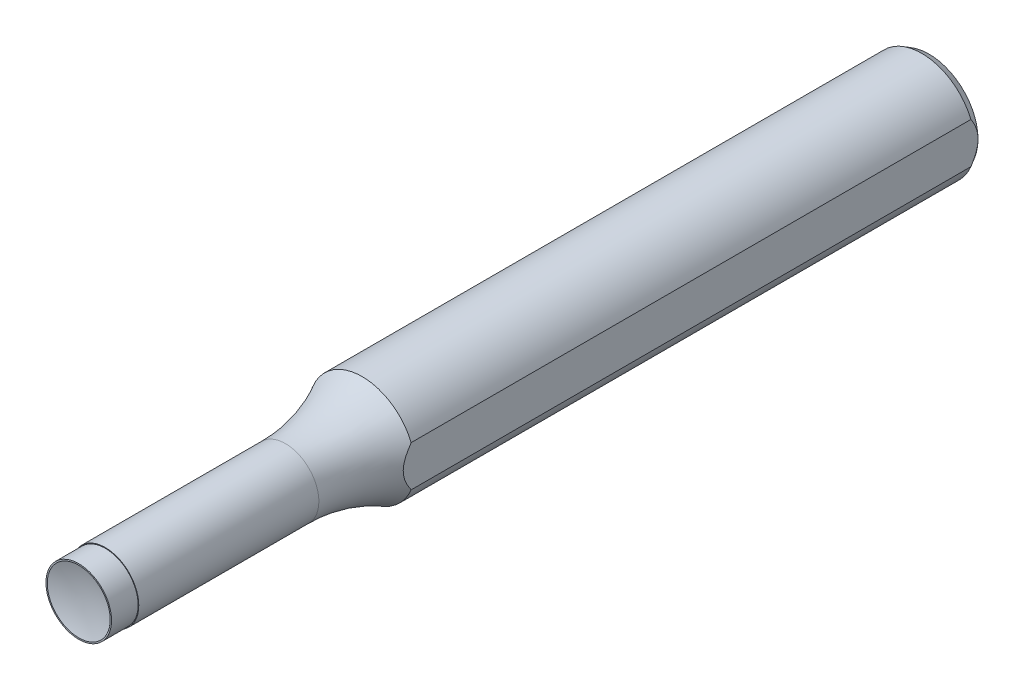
SolidWorks part; units mm, degrees
ref_plane "Front Plane" through (0, 0, 0) normal (0, 0, 1) x (1, 0, 0)
ref_plane "Top Plane" through (0, 0, 0) normal (0, 1, 0) x (1, 0, 0)
ref_plane "Right Plane" through (0, 0, 0) normal (1, 0, 0) x (0, 0, -1)
sketch "Sketch1" plane through (0, 0, 0) normal (0, 0, 1) x (1, 0, 0)
  circle A0 centre (0, 0) radius 7.94
  dimension "D1" = 15.88
extrude "Boss-Extrude1" add sketch "Sketch1" against normal blind 127
sketch "Sketch2" plane through (0, 0, 0) normal (0, 0, 1) x (1, 0, 0)
  circle A0 centre (0, 0) radius 5
  dimension "D1" = 10
extrude "Cut-Extrude1" cut sketch "Sketch2" against normal blind 42.3333 flip side to cut
sketch "Sketch3" plane through (0, 0, 0) normal (0, 0, 1) x (1, 0, 0)
  circle A0 centre (0, 0) radius 4.9
  dimension "D1" = 9.8
extrude "Cut-Extrude2" cut sketch "Sketch3" against normal blind 3.97 flip side to cut
sketch "Sketch4" plane through (0, 0, 0) normal (1, 0, 0) x (0, 0, -1)
  line L0 (0, 0) -> (0, 4.7)
  line L1 (0, 4.9) -> (0, -4.9) construction
  line L2 (0.7115, 0) -> (0.7115, 4.7) construction
  line L3 (0, 0) -> (0.7115, 0)
  line L4 (0, 0) -> (0, -4.7) construction
  arc A0 (0.7115, 0) -> (0, 4.7) centre (-15.1685, 0) ccw
  dimension "D2" = 15.88
  dimension "D1" = 9.4
revolve "Cut-Revolve1" cut sketch "Sketch4" angle 360 about L3
chamfer "Chamfer1" distance 1.0587 angle 30 1 edges at (7.94, 0, -127)
sketch "Sketch5" plane through (0, 0, 0) normal (1, 0, 0) x (0, 0, -1)
  line L0 (42.3333, 0) -> (30.8696, 0)
  line L1 (42.3333, 7.94) -> (42.3333, -7.94) construction
  line L2 (30.8696, 0) -> (30.8696, 5)
  line L3 (42.3333, 5) -> (3.97, 5) construction
  line L4 (42.3333, 7.94) -> (42.3333, 0)
  line L5 (30.8696, 5) -> (42.3333, 5) construction
  arc A0 (30.8696, 5) -> (42.3333, 7.94) centre (30.8696, 28.82) ccw
  dimension "D1" = 23.82
revolve "Revolve1" add sketch "Sketch5" angle 360 about L0
sketch "Sketch6" plane through (0, 0, 0) normal (1, 0, 0) x (0, 0, -1)
  line L0 (84.6667, 0) -> (108.4867, 0)
  line L1 (84.6667, 0) -> (84.6667, 15.88)
  line L2 (84.6667, 15.88) -> (94.7342, 15.88)
  line L3 (108.4867, 0) -> (108.4867, 7.94)
  line L4 (125.9413, 7.94) -> (42.3333, 7.94) construction
  line L5 (108.4867, 7.94) -> (84.6667, 7.94) construction
  line L6 (127, -7.94) -> (127, 7.94) construction
  arc A0 (108.4867, 7.94) -> (94.7342, 15.88) centre (108.4867, 23.82) cw
  dimension "D2" = 15.88
  dimension "D1" = 42.3333
  dimension "D3" = 23.82
revolve "Revolve2" [suppressed] add sketch "Sketch6" angle 360 about L0
sketch "Sketch7" plane through (0, 0, -127) normal (0, 0, -1) x (-1, 0, 0)
  line L9 (-13.4386, 3.0549) -> (-7.3288, 3.0549)
  line L10 (-13.4386, 3.0549) -> (-13.4386, -3.0549)
  line L11 (-13.4386, -3.0549) -> (-7.3288, -3.0549)
  line L12 (-7.3288, 3.0549) -> (-7.3288, -3.0549)
  circle A5 centre (0, 0) radius 7.94 construction
  circle A6 centre (0, 0) radius 7.3288 construction
  point P8 (-7.3288, 0)
extrude "Cut-Extrude3" cut sketch "Sketch7" against normal through all
